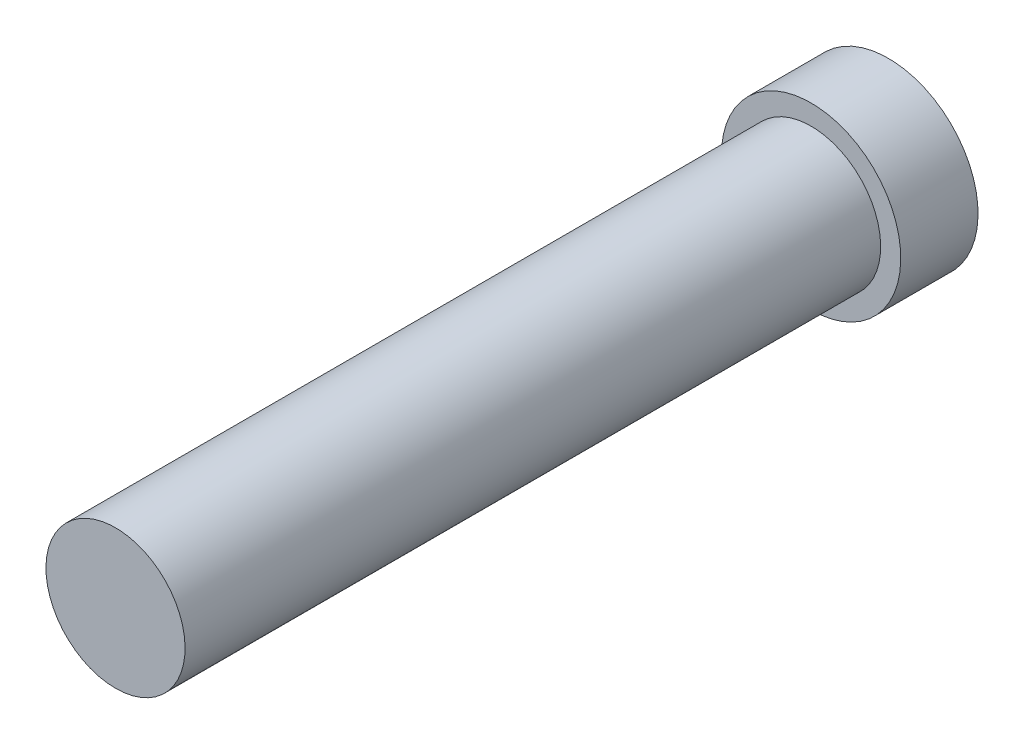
SolidWorks part; units mm, degrees
ref_plane "Front Plane" through (0, 0, 0) normal (0, 0, 1) x (1, 0, 0)
ref_plane "Top Plane" through (0, 0, 0) normal (0, 1, 0) x (1, 0, 0)
ref_plane "Right Plane" through (0, 0, 0) normal (1, 0, 0) x (0, 0, -1)
sketch "Sketch2" plane through (0, 0, 0) normal (1, 0, 0) x (0, 0, -1)
  line L0 (-25, 0) -> (25, 0) construction
  line L1 (25, 0) -> (25, 5.8)
  line L2 (25, 5.8) -> (20, 5.8)
  line L3 (20, 5.8) -> (20, 4.5)
  line L4 (20, 4.5) -> (-25, 4.5)
  line L5 (-25, 4.5) -> (-25, 0)
  line L6 (-25, 0) -> (25, 0)
  point P4 (0, 0)
  dimension "D1" = 50
  dimension "D2" = 5
  dimension "D3" = 4.5
  dimension "D4" = 5.8
revolve "Revolve1" add sketch "Sketch2" angle 360 about L0
sketch "Sketch3" plane through (0, 0, -25) normal (0, 0, -1) x (-1, 0, 0)
  line L0 (0, 0) -> (0, 3) construction
  line L1 (0, 0) -> (2.5981, 1.5) construction
  line L2 (0, 0) -> (2.5981, -1.5) construction
  line L3 (0, 0) -> (0, -3) construction
  line L4 (0, 0) -> (-2.5981, -1.5) construction
  line L5 (0, 0) -> (-2.5981, 1.5) construction
  line L6 (0, 3) -> (2.5981, 1.5)
  line L7 (2.5981, 1.5) -> (2.5981, -1.5)
  line L8 (2.5981, -1.5) -> (0, -3)
  line L9 (0, -3) -> (-2.5981, -1.5)
  line L10 (-2.5981, -1.5) -> (-2.5981, 1.5)
  line L11 (-2.5981, 1.5) -> (0, 3)
  circle A0 centre (0, 0) radius 3 construction
  point P11 (0, 0)
  dimension "D1" = 6
  dimension "D2" = 6
extrude "Cut-Extrude1" cut sketch "Sketch3" against normal blind 3
fillet "Fillet1" radius 0.1 6 edges at (2.5981, 0, -25) (1.299, -2.25, -25) (-1.299, -2.25, -25) (-2.5981, 0, -25) (-1.299, 2.25, -25) (1.299, 2.25, -25)
fillet "Fillet2" radius 0.1 6 edges at (-1.299, 2.25, -22) (-2.5981, 0, -22) (-1.299, -2.25, -22) (1.299, -2.25, -22) (2.5981, 0, -22) (1.299, 2.25, -22)
